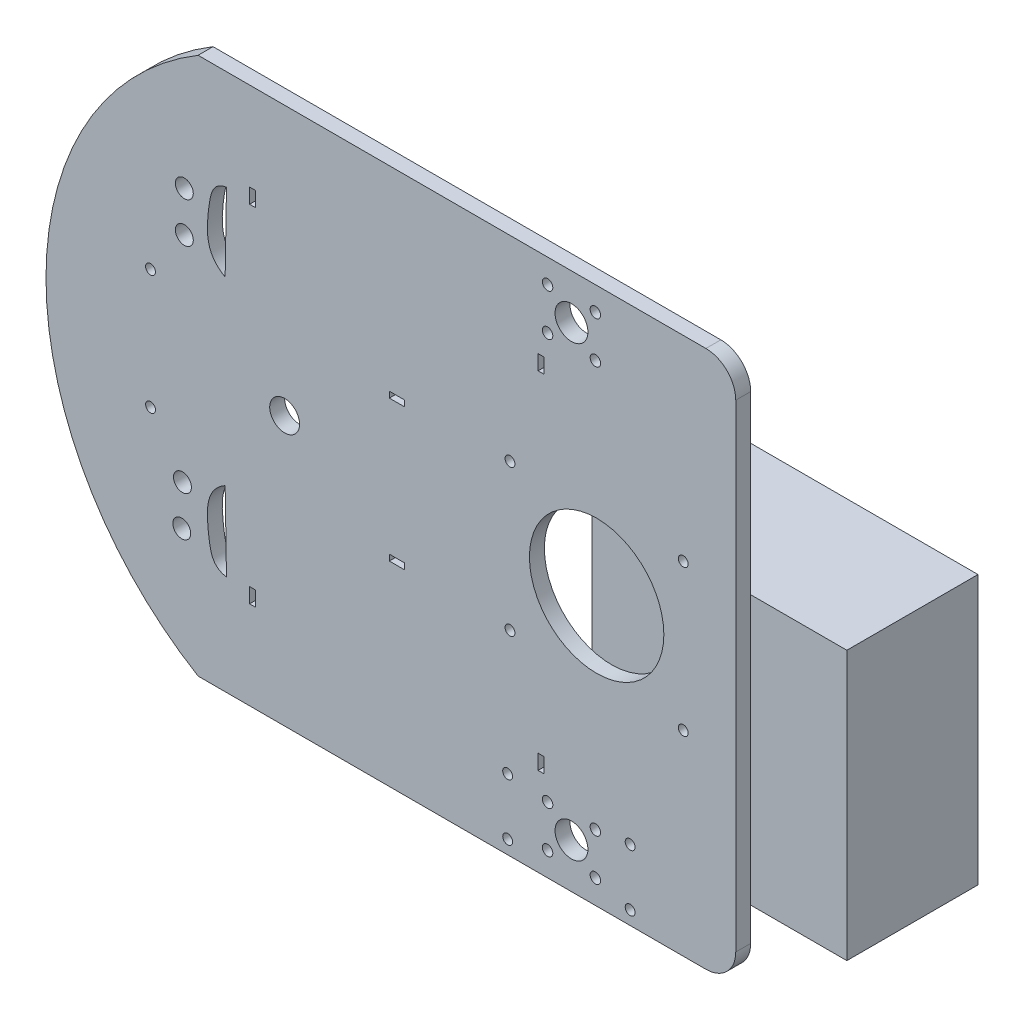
SolidWorks part; units mm, degrees
ref_plane "前视基准面" through (0, 0, 0) normal (0, 0, 1) x (1, 0, 0)
ref_plane "上视基准面" through (0, 0, 0) normal (0, 1, 0) x (1, 0, 0)
ref_plane "右视基准面" through (0, 0, 0) normal (1, 0, 0) x (0, 0, -1)
other "Configuration Table"
sketch "草图1" plane through (0, 0, 0) normal (0, 0, 1) x (1, 0, 0)
  line L0 (-10, 0) -> (-180, 0)
  line L1 (-180, 0) -> (-180, 180)
  line L2 (-180, 180) -> (-10, 180)
  line L3 (0, 170) -> (0, 10)
  line L4 (-180, 90) -> (-253.1844, 90) construction
  arc A0 (-180, 180) -> (-180, 0) centre (-125.9167, 90) ccw
  arc A1 (-10, 0) -> (0, 10) centre (-10, 10) ccw
  arc A2 (-10, 180) -> (0, 170) centre (-10, 170) cw
  point P11 (0, 0)
  dimension "D3" = 105
  dimension "D4" = 10
  dimension "D1" = 180
  dimension "D2" = 180
extrude "凸台-拉伸1" add sketch "草图1" along normal blind 5
sketch "草图4" plane through (0, 0, 5) normal (0, 0, 1) x (1, 0, 0)
  line L0 (0, 90) -> (-55, 90) construction
  line L1 (0, 170) -> (0, 10) construction
  line L2 (-55, 165) -> (-55, 15) construction
  dimension "D1" = 55
  dimension "D2" = 75
sketch "草图6" plane through (0, 0, 5) normal (0, 0, 1) x (1, 0, 0)
  line L0 (-230.9167, 90) -> (-195.9167, 90) construction
  line L1 (-195.9167, 70) -> (-195.9167, 110) construction
  arc A0 (-180, 180) -> (-180, 0) centre (-125.9167, 90) ccw construction
  circle A1 centre (-195.9167, 110) radius 1.65
  circle A2 centre (-195.9167, 70) radius 1.65
  dimension "D3" = 3.3
  dimension "D1" = 35
  dimension "D2" = 20
extrude "切除-拉伸2" cut sketch "草图6" against normal through all
sketch "草图7" plane through (0, 0, 0) normal (0, 0, -1) x (-1, 0, 0)
  line L0 (0, 90) -> (111.0978, 90) construction
  circle A0 centre (47, 158) radius 1.75
  circle A1 centre (47, 172) radius 1.75
  circle A2 centre (63, 172) radius 1.75
  circle A3 centre (63, 158) radius 1.75
  circle A4 centre (55, 165) radius 5.5
  circle A5 centre (55, 15) radius 5.5
  circle A6 centre (47, 22) radius 1.75
  circle A7 centre (63, 22) radius 1.75
  circle A8 centre (63, 8) radius 1.75
  circle A9 centre (47, 8) radius 1.75
  dimension "D1" = 3.5
  dimension "D2" = 11
extrude "切除-拉伸3" cut sketch "草图7" against normal blind 10
sketch "草图11" plane through (0, 0, 5) normal (0, 0, 1) x (1, 0, 0)
  circle A0 centre (-75.5735, 114.5018) radius 1.65
  circle A1 centre (-17.5735, 114.5018) radius 1.65
  circle A2 centre (-17.5735, 65.5052) radius 1.65
  circle A3 centre (-75.5735, 65.5052) radius 1.65
extrude "切除-拉伸4" cut sketch "草图11" against normal through all
sketch "草图13" plane through (0, 0, 5) normal (0, 0, 1) x (1, 0, 0)
  line L0 (0, 90) -> (-150, 90)
  line L2 (0, 170) -> (0, 10) construction
  line L3 (-150, 90) -> (-150, 75)
  line L4 (-147.5, 104) -> (-152.5, 106) construction
  line L5 (-147.5, 74) -> (-152.5, 74)
  line L6 (-147.5, 74) -> (-147.5, 76)
  line L7 (-147.5, 76) -> (-152.5, 76)
  line L8 (-152.5, 74) -> (-152.5, 76)
  line L9 (-147.5, 74) -> (-152.5, 76) construction
  line L10 (-147.5, 76) -> (-152.5, 74) construction
  line L11 (-147.5, 106) -> (-152.5, 104) construction
  line L12 (-152.5, 106) -> (-152.5, 104)
  line L13 (-147.5, 104) -> (-152.5, 104)
  line L14 (-147.5, 106) -> (-147.5, 104)
  line L15 (-147.5, 106) -> (-152.5, 106)
  dimension "D1" = 150
  dimension "D2" = 15
  dimension "D3" = 2
  dimension "D4" = 5
sketch "草图14" plane through (0, 0, 0) normal (0, 0, -1) x (-1, 0, 0)
  circle A0 centre (17.5735, 114.5018) radius 1.75
  circle A1 centre (17.5735, 65.5052) radius 1.75
  circle A2 centre (75.5735, 114.5018) radius 1.75
  circle A3 centre (75.5735, 65.5052) radius 1.75
  dimension "D1" = 3.5
  dimension "D2" = 3.5
  dimension "D3" = 3.5
  dimension "D4" = 3.5
sketch "草图17" plane through (0, 0, 0) normal (0, 0, -1) x (-1, 0, 0)
  line L0 (69.1697, 120.12) -> (69.1697, 175.7221) construction
  line L2 (113.4697, 117.396) -> (113.4697, 204.0764) construction
  line L3 (66.1697, 150.421) -> (64.1697, 150.421)
  line L4 (66.1697, 150.421) -> (66.1697, 145.421)
  line L5 (66.1697, 145.421) -> (64.1697, 145.421)
  line L6 (64.1697, 150.421) -> (64.1697, 145.421)
  line L7 (66.1697, 150.421) -> (64.1697, 145.421) construction
  line L8 (66.1697, 145.421) -> (64.1697, 150.421) construction
  line L9 (154.4957, 117.396) -> (72.4436, 117.396) construction
  line L10 (160.7697, 145.421) -> (162.7697, 150.421) construction
  line L11 (160.7697, 150.421) -> (162.7697, 145.421) construction
  line L12 (162.7697, 150.421) -> (162.7697, 145.421)
  line L13 (160.7697, 145.421) -> (162.7697, 145.421)
  line L14 (160.7697, 150.421) -> (160.7697, 145.421)
  line L15 (160.7697, 150.421) -> (162.7697, 150.421)
  line L16 (0, 90) -> (258.0269, 90) construction
  line L17 (0, 170) -> (0, 10) construction
  line L18 (160.7697, 29.579) -> (162.7697, 34.579) construction
  line L19 (160.7697, 34.579) -> (162.7697, 29.579) construction
  line L20 (66.1697, 34.579) -> (64.1697, 29.579) construction
  line L21 (66.1697, 29.579) -> (64.1697, 34.579) construction
  line L22 (160.7697, 29.579) -> (162.7697, 29.579)
  line L23 (160.7697, 29.579) -> (160.7697, 34.579)
  line L24 (160.7697, 34.579) -> (162.7697, 34.579)
  line L25 (162.7697, 29.579) -> (162.7697, 34.579)
  line L26 (64.1697, 29.579) -> (64.1697, 34.579)
  line L27 (66.1697, 34.579) -> (64.1697, 34.579)
  line L28 (66.1697, 29.579) -> (66.1697, 34.579)
  line L29 (66.1697, 29.579) -> (64.1697, 29.579)
  line L30 (69.4446, 32.079) -> (66.4446, 32.079)
  line L31 (157.7697, 175.7221) -> (157.7697, 120.12) construction
  dimension "D1" = 5
  dimension "D2" = 2
  dimension "D3" = 3
  dimension "D4" = 3
extrude "切除-拉伸9" cut sketch "草图17" against normal through all contours L15 L14 L13 L12 | L6 L5 L4 L3
sketch "草图20" plane through (0, 0, 0) normal (0, 0, -1) x (-1, 0, 0)
  line L0 (0, 90) -> (269.7577, 90) construction
  line L1 (0, 170) -> (0, 10) construction
  line L2 (64.1697, 150.421) -> (64.1697, 145.421)
  line L3 (64.1697, 145.421) -> (66.1697, 145.421)
  line L4 (66.1697, 145.421) -> (64.1697, 145.421) construction
  line L5 (66.1697, 145.421) -> (66.1697, 150.421)
  line L6 (66.1697, 150.421) -> (64.1697, 150.421)
  line L7 (160.7697, 150.421) -> (160.7697, 145.421)
  line L8 (160.7697, 145.421) -> (162.7697, 145.421)
  line L9 (162.7697, 145.421) -> (162.7697, 150.421)
  line L10 (162.7697, 150.421) -> (162.7697, 145.421) construction
  line L11 (160.7697, 150.421) -> (162.7697, 150.421) construction
  line L12 (162.7697, 150.421) -> (160.7697, 150.421)
  line L13 (162.7697, 29.579) -> (160.7697, 29.579)
  line L14 (162.7697, 34.579) -> (162.7697, 29.579)
  line L15 (160.7697, 34.579) -> (162.7697, 34.579)
  line L16 (160.7697, 29.579) -> (160.7697, 34.579)
  line L17 (66.1697, 29.579) -> (64.1697, 29.579)
  line L18 (66.1697, 34.579) -> (66.1697, 29.579)
  line L19 (64.1697, 34.579) -> (66.1697, 34.579)
  line L20 (64.1697, 29.579) -> (64.1697, 34.579)
extrude "切除-拉伸10" cut sketch "草图20" against normal through all
sketch "草图27" plane through (0, 0, 0) normal (0, 0, -1) x (-1, 0, 0)
  line L0 (154.7707, 117.121) -> (82.4174, 117.1229) construction
  line L3 (115.9697, 112.6221) -> (110.9697, 112.6221)
  line L4 (115.9697, 112.6221) -> (115.9697, 114.6221)
  line L5 (115.9697, 114.6221) -> (110.9697, 114.6221)
  line L6 (110.9697, 112.6221) -> (110.9697, 114.6221)
  line L7 (115.9697, 112.6221) -> (110.9697, 114.6221) construction
  line L8 (115.9697, 114.6221) -> (110.9697, 112.6221) construction
  line L9 (230.9167, 90) -> (-21.6627, 90) construction
  line L10 (115.9697, 65.3779) -> (110.9697, 67.3779) construction
  line L11 (115.9697, 67.3779) -> (110.9697, 65.3779) construction
  line L12 (110.9697, 67.3779) -> (110.9697, 65.3779)
  line L13 (115.9697, 65.3779) -> (110.9697, 65.3779)
  line L14 (115.9697, 67.3779) -> (115.9697, 65.3779)
  line L15 (115.9697, 67.3779) -> (110.9697, 67.3779)
  arc A0 (180, 0) -> (180, 180) centre (125.9167, 90) ccw construction
  point P4 (113.4697, 113.6221)
  point P17 (113.4697, 66.3779)
  dimension "D1" = 3.5
extrude "切除-拉伸14" cut sketch "草图27" against normal through all
sketch "草图28" plane through (0, 0, 0) normal (0, 0, -1) x (-1, 0, 0)
  line L0 (0, 90) -> (299.643, 90)
  line L1 (0, 170) -> (0, 10) construction
sketch "草图29" plane through (0, 0, 0) normal (0, 1, 0) x (1, 0, 0)
  line L1 (-74.1896, 65.0076) -> (11.0903, 65.0076)
  line L2 (-74.1896, 65.0076) -> (-74.1896, 21.1016)
  line L4 (-74.1896, 21.1016) -> (11.0903, 21.1016)
  line L5 (11.0903, 65.0076) -> (11.0903, 21.1016)
extrude "凸台-拉伸2" add sketch "草图29" along normal blind 90 separate body
sketch "草图32" plane through (0, 0, 5) normal (0, 0, 1) x (1, 0, 0)
  line L0 (-230.9167, 90) -> (-111.8506, 88.9622) construction
  circle A0 centre (-184.6078, 139.1174) radius 3
  circle A1 centre (-184.6078, 125.5908) radius 3
  arc A2 (-180, 180) -> (-180, 0) centre (-125.9167, 90) ccw construction
  circle A3 centre (-185.2352, 53.6074) radius 3
  circle A4 centre (-185.471, 40.0829) radius 3
  dimension "D1" = 6
extrude "切除-拉伸15" cut sketch "草图32" against normal blind 10
sketch "草图35" plane through (0, 0, 5) normal (0, 0, 1) x (1, 0, 0)
  line L0 (-230.9167, 90) -> (-76.9996, 90) construction
  arc A0 (-180, 180) -> (-180, 0) centre (-125.9167, 90) ccw construction
  circle A1 centre (-151.0268, 90) radius 5
  dimension "D1" = 10
extrude "切除-拉伸16" cut sketch "草图35" against normal blind 10
sketch "草图37" plane through (0, 0, 0) normal (0, 0, -1) x (-1, 0, 0)
  line L0 (17.5735, 114.5018) -> (17.5735, 65.5052)
  line L1 (17.5735, 65.5052) -> (75.5735, 65.5052)
  line L2 (75.5735, 65.5052) -> (75.5735, 114.5018)
  line L3 (75.5735, 114.5018) -> (17.5735, 114.5018)
  line L4 (17.5735, 114.5018) -> (75.5735, 65.5052)
  line L5 (75.5735, 114.5018) -> (17.5735, 65.5052)
  circle A0 centre (46.5735, 90.0035) radius 22.5
extrude "切除-拉伸17" cut sketch "草图37" against normal blind 10 contours L5 A0 L4 | L4 A0 L5 | L4 A0 L5 | L5 A0 L4
sketch "草图39" plane through (0, 0, 5) normal (0, 0, 1) x (1, 0, 0)
  line L0 (-170.4865, 32.8705) -> (-170.9397, 59.7643)
  line L1 (-230.9167, 90) -> (33.6258, 90) construction
  line L2 (-170.4865, 147.1295) -> (-170.9397, 120.2357)
  arc A0 (-180, 180) -> (-180, 0) centre (-125.9167, 90) ccw construction
  spline S0 degree 3 poles (-170.4865, 33.5023) (-175.1377, 34.1633) (-177.0282, 44.9221) (-177.863, 55.9353) (-170.9397, 59.7643) knots 0 0 0 0 0.355909 1 1 1 1
  spline S1 degree 3 poles (-170.4865, 146.4977) (-175.1377, 145.8367) (-177.0282, 135.0779) (-177.863, 124.0647) (-170.9397, 120.2357) knots 0 0 0 0 0.355909 1 1 1 1
extrude "切除-拉伸19" cut sketch "草图39" against normal blind 10 contours S0 L0 | L2 S1
sketch "草图40" plane through (0, 0, 5) normal (0, 0, 1) x (1, 0, 0)
  circle A2 centre (-76.3701, 23.5216) radius 1.65
  circle A3 centre (-35.3599, 23.5206) radius 1.65
  circle A4 centre (-76.3599, 4.5516) radius 1.65
  circle A5 centre (-35.3599, 4.5516) radius 1.65
extrude "切除-拉伸20" cut sketch "草图40" against normal blind 10
